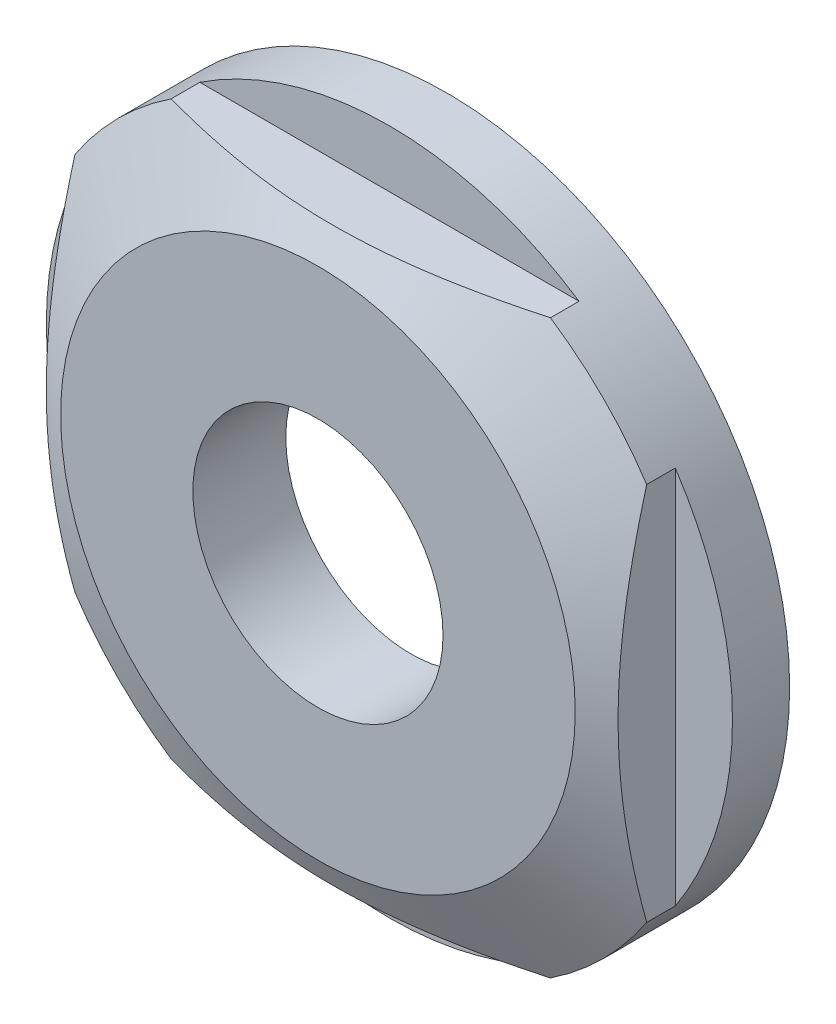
SolidWorks part; units mm, degrees
ref_plane "Face" through (0, 0, 0) normal (0, 0, 1) x (1, 0, 0)
ref_plane "Dessus" through (0, 0, 0) normal (0, 1, 0) x (1, 0, 0)
ref_plane "Droite" through (0, 0, 0) normal (1, 0, 0) x (0, 0, -1)
sketch "Esquisse1" plane through (0, 0, 0) normal (0, 0, 1) x (1, 0, 0)
  circle A1 centre (0, 0) radius 24
  dimension "D1" = 48
extrude "Base-Extrusion" add sketch "Esquisse1" against normal blind 9
chamfer "Chanfrein2" distance 3 distance2 6 1 edges at (24, 0, 0)
sketch "Esquisse2" plane through (0, 0, 0) normal (0, 0, 1) x (1, 0, 0)
  line L4 (16.1392, 20) -> (16.1392, 25.1876)
  line L5 (16.1392, 25.1876) -> (-16.4872, 25.1876)
  line L6 (-16.4872, 25.1876) -> (-16.4872, 20)
  line L7 (-20, 17.5313) -> (-27.1017, 17.5313)
  line L8 (-27.1017, 17.5313) -> (-27.1017, -14.8341)
  line L9 (-20, -14.8341) -> (-27.1017, -14.8341)
  line L10 (17.9663, -20) -> (17.9663, -24.8147)
  line L11 (-17.6183, -20) -> (-17.6183, -24.8147)
  line L12 (20, 18.1403) -> (27.5367, 18.1403)
  line L13 (20, -16.8352) -> (27.5367, -16.8352)
  line L14 (27.5367, 18.1403) -> (27.5367, -16.8352)
  line L15 (-17.6183, -24.8147) -> (17.9663, -24.8147)
  line L16 (-16.4872, 20) -> (16.1392, 20)
  line L18 (-20, 17.5313) -> (-20, -14.8341)
  line L19 (20, 18.1403) -> (20, -16.8352)
  line L23 (-17.6183, -20) -> (17.9663, -20)
extrude "Enlèv. mat.-Extru.1" cut sketch "Esquisse2" against normal blind 5
hole_wizard "Diamètre du perçage Ø17.5 (17.5)1" positions "Esquisse4" profile "Esquisse3" hole size "Ø17.5" standard "ISO"
sketch "Esquisse4" plane through (0, 0, 0) normal (0, 0, 1) x (1, 0, 0)
  circle A0 centre (0, 0) radius 18 construction
  point P0 (0, 0)
sketch "Esquisse3" plane through (0, 0, 0) normal (1, 0, 0) x (0, -1, 0)
  line L0 (0, 0) -> (0, 9)
  line L1 (0, 9) -> (8.75, 9)
  line L2 (8.75, 9) -> (8.75, 0)
  line L5 (8.75, 0) -> (0, 0)
  line L11 (0, -6.35) -> (0, 107.95) construction
  dimension "Diamètre du perçage jusqu'au prochain" = 17.5
  dimension "Profondeur du perçage jusqu'au prochain" = 9
sketch "Esquisse5" plane through (0, 0, -9) normal (0, 0, -1) x (-1, 0, 0)
  circle A0 centre (0, 0) radius 4.0223
  circle A1 centre (0, 0) radius 17.5
  dimension "D1" = 35
extrude "Enlèv. mat.-Extru.2" cut sketch "Esquisse5" against normal blind 2.5
thread "Filetage1" pitch 2.5 start angle 0, offset 5, length 15, pitch 2.5, diameter 17.5
ref_plane "Plan1" through (-8.75, 0, 5) normal (0, -1, 0) x (-1, 0, 0)
sketch "Profil de filetage1" plane through (-8.75, 0, 5) normal (0, -1, 0) x (-1, 0, 0)
  line L0 (0, 0) -> (0, 2.5) construction
  line L1 (0, 0) -> (1.3532, 0.7812)
  line L2 (1.3532, 0.7812) -> (1.3532, 1.0937)
  line L3 (1.3532, 1.0937) -> (0, 1.875)
  line L4 (1.3532, 0.9375) -> (0, 0.9375) construction
  line L11 (0, 0) -> (0, 1.875)
  point P2 (0, 0)
  dimension "Pitch" = 2.5
  dimension "Profile_Angle" = 60
  dimension "Profile_Land" = 0.3125
  dimension "Profile_Height" = 1.3532
